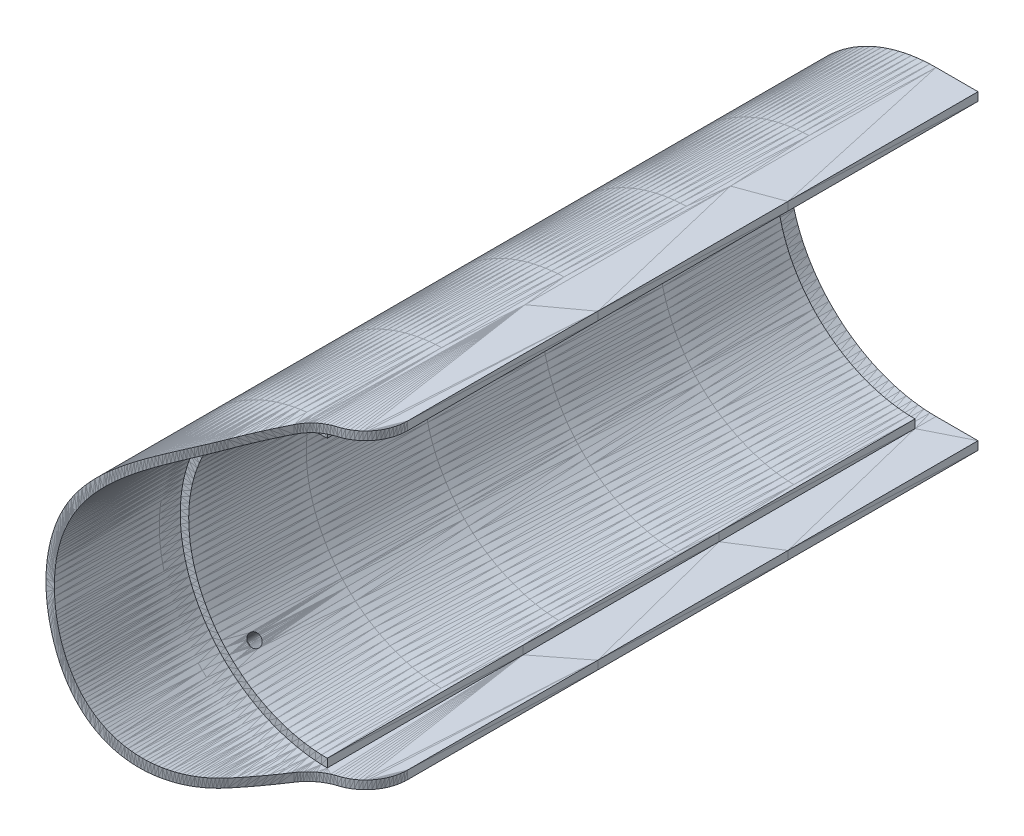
SolidWorks part; units mm, degrees
ref_plane "Front Plane" through (0, 0, 0) normal (0, 0, 1) x (1, 0, 0)
ref_plane "Top Plane" through (0, 0, 0) normal (0, 1, 0) x (1, 0, 0)
ref_plane "Right Plane" through (0, 0, 0) normal (1, 0, 0) x (0, 0, -1)
imported_body "Imported1"
imported_body "Imported2"
delete or keep bodies "Body-Delete/Keep 1" type delete bodies bodies 102
